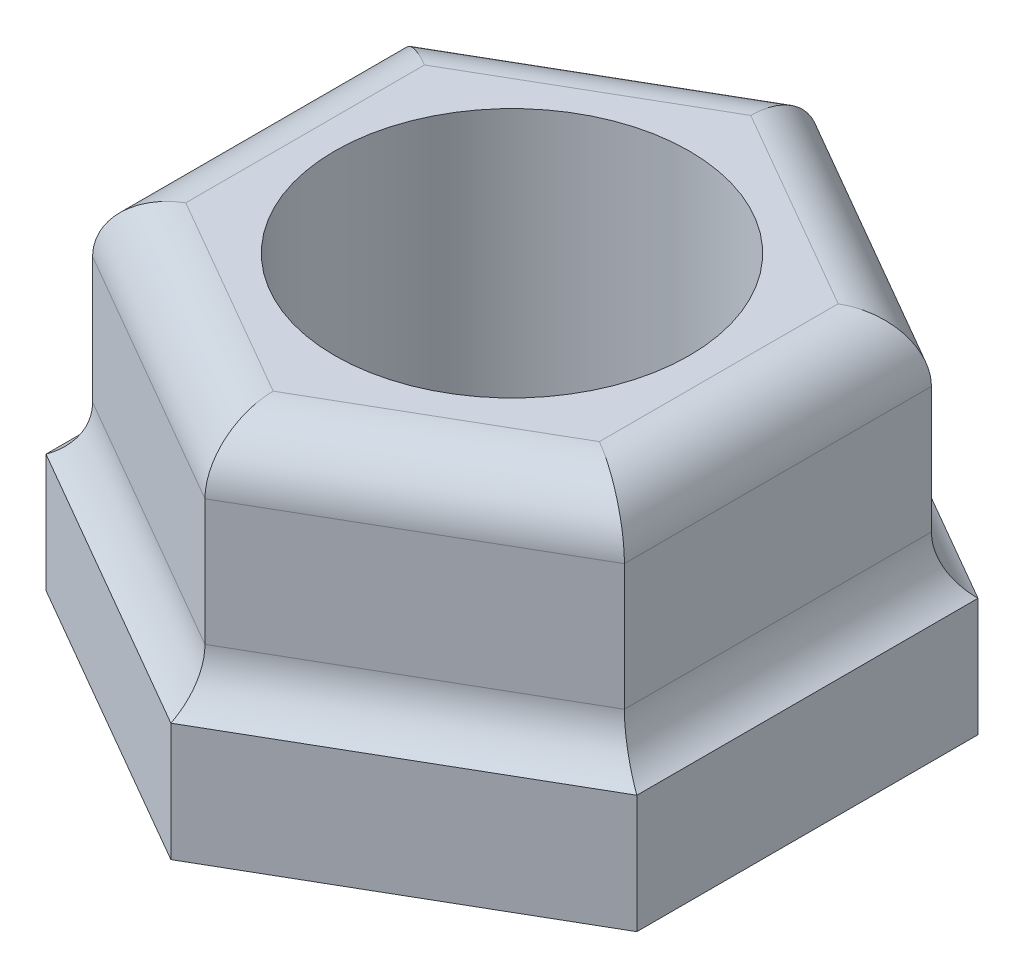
SolidWorks part; units mm, degrees
ref_plane "Front Plane" through (0, 0, 0) normal (0, 0, 1) x (1, 0, 0)
ref_plane "Top Plane" through (0, 0, 0) normal (0, 1, 0) x (1, 0, 0)
ref_plane "Right Plane" through (0, 0, 0) normal (1, 0, 0) x (0, 0, -1)
sketch "Sketch1" plane through (0, 0, 0) normal (0, 1, 0) x (1, 0, 0)
  line L1 (0, -2.8868) -> (2.5, -1.4434)
  line L2 (2.5, -1.4434) -> (2.5, 1.4434)
  line L3 (2.5, 1.4434) -> (0, 2.8868)
  line L4 (0, 2.8868) -> (-2.5, 1.4434)
  line L5 (-2.5, 1.4434) -> (-2.5, -1.4434)
  line L6 (-2.5, -1.4434) -> (0, -2.8868)
  circle A0 centre (0, 0) radius 2.5 construction
  circle A1 centre (0, 0) radius 1.5
  dimension "D1" = 5
  dimension "D2" = 3
extrude "Boss-Extrude1" add sketch "Sketch1" along normal blind 3
sketch "Sketch2" plane through (0, 3, 0) normal (0, 1, 0) x (1, 0, 0)
  line L27 (2.25, 1.299) -> (0, 2.5981)
  line L28 (2.25, -1.299) -> (2.25, 1.299)
  line L29 (0, -2.5981) -> (2.25, -1.299)
  line L30 (-2.25, -1.299) -> (0, -2.5981)
  line L31 (-2.25, 1.299) -> (-2.25, -1.299)
  line L32 (0, 2.5981) -> (-2.25, 1.299)
  line L33 (2.25, 1.299) -> (0, 2.5981)
  line L34 (2.25, -1.299) -> (2.25, 1.299)
  line L35 (0, -2.5981) -> (2.25, -1.299)
  line L36 (-2.25, -1.299) -> (0, -2.5981)
  line L37 (-2.25, 1.299) -> (-2.25, -1.299)
  line L38 (0, 2.5981) -> (-2.25, 1.299)
  circle A0 centre (0, 0) radius 3.633
  dimension "D1" = 0.25
extrude "Cut-Extrude1" cut sketch "Sketch2" against normal blind 2
fillet "Fillet1" radius 0.5 12 edges at (1.125, 1, -1.9486) (-1.125, 1, -1.9486) (-2.25, 1, 0) (-1.125, 1, 1.9486) (1.125, 1, 1.9486) (2.25, 1, 0) (1.125, 3, -1.9486) (-1.125, 3, -1.9486) (-2.25, 3, 0) (-1.125, 3, 1.9486) (1.125, 3, 1.9486) (2.25, 3, 0)
